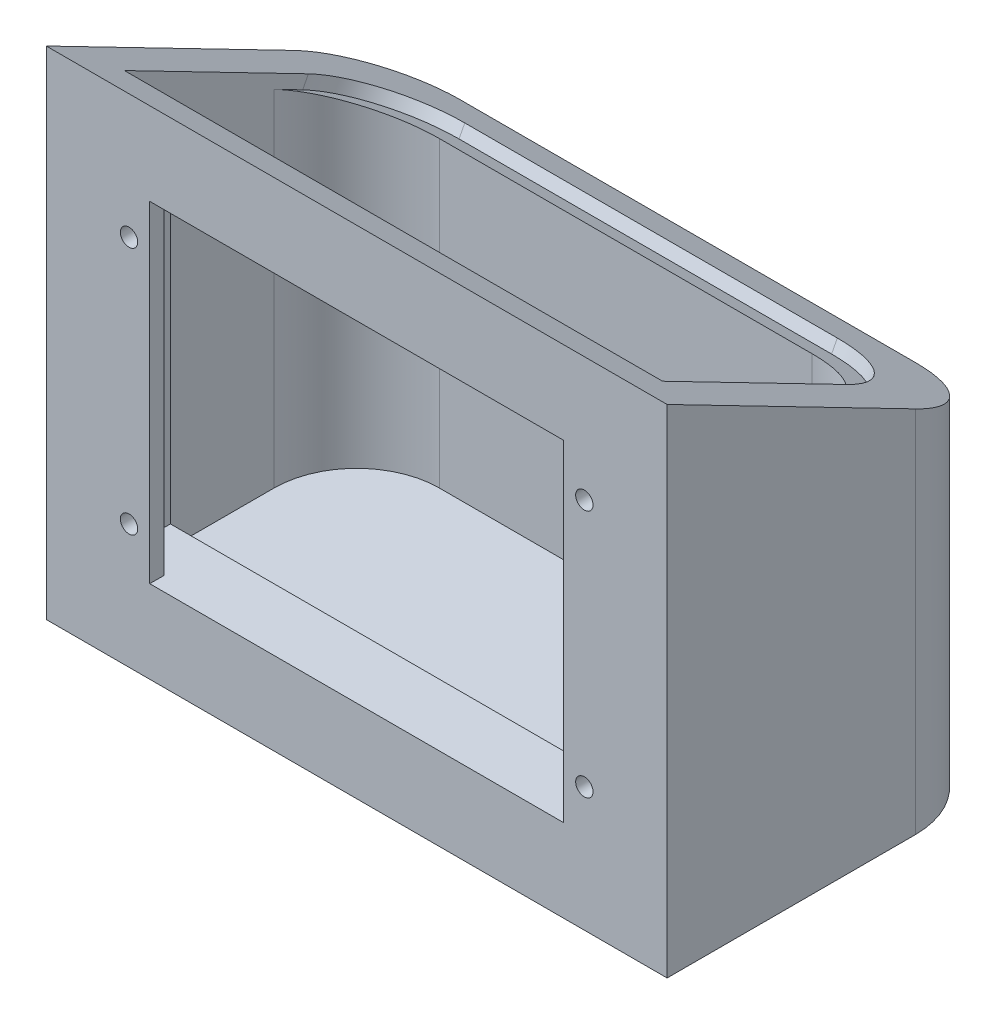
SolidWorks part; units mm, degrees
ref_plane "Alzado" through (0, 0, 0) normal (0, 0, 1) x (1, 0, 0)
ref_plane "Planta" through (0, 0, 0) normal (0, 1, 0) x (1, 0, 0)
ref_plane "Vista lateral" through (0, 0, 0) normal (1, 0, 0) x (0, 0, -1)
sketch "Sketch1" plane through (0, 0, 0) normal (1, 0, 0) x (0, 0, -1)
  line L0 (0, 0) -> (0, 120)
  line L1 (0, 120) -> (80, 78.7689)
  line L2 (80, 78.7689) -> (80, 0)
  line L3 (80, 0) -> (0, 0)
  dimension "D1" = 90
  dimension "D2" = 80
  dimension "D3" = 120
extrude "Boss-Extrude1" add sketch "Sketch1" along normal blind 150
sketch "Sketch2" plane through (0, 94.8148, -48.8664) normal (0, 0.8889, -0.4581) x (1, 0, 0)
  line L0 (150, -54.9747) -> (0, -54.9747) construction
  line L1 (30, 25.0253) -> (120, 25.0253)
  line L2 (10, 5.0253) -> (10, -44.9747)
  line L3 (10, -44.9747) -> (140, -44.9747)
  line L4 (140, 5.0253) -> (140, -44.9747)
  line L5 (0, 35.0253) -> (0, -54.9747) construction
  arc A0 (120, 25.0253) -> (140, 5.0253) centre (120, 5.0253) cw
  arc A1 (30, 25.0253) -> (10, 5.0253) centre (30, 5.0253) ccw
  dimension "D5" = 20
  dimension "D1" = 70
  dimension "D2" = 10
  dimension "D3" = 130
  dimension "D4" = 10
extrude "Cut-Extrude1" cut sketch "Sketch2" against normal blind 3
fillet "Fillet1" radius 20 2 edges at (0, 39.3845, -80) (150, 39.3845, -80)
sketch "Sketch4" plane through (0, 0, 0) normal (0, -1, 0) x (1, 0, 0)
  line L0 (140, -15) -> (140, -45)
  line L5 (30, -65) -> (120, -65)
  line L6 (10, -15) -> (10, -45)
  line L7 (10, -15) -> (140, -15)
  line L8 (150, 0) -> (0, 0) construction
  arc A0 (120, -65) -> (140, -45) centre (120, -45) ccw
  arc A1 (30, -65) -> (10, -45) centre (30, -45) cw
  dimension "D4" = 130
  dimension "D1" = 20
  dimension "D2" = 15
  dimension "D3" = 50
extrude "Cut-Extrude6" cut sketch "Sketch4" against normal up to surface (98.8942 mm away) from offset 10
sketch "Sketch5" plane through (0, 0, 0) normal (0, 0, 1) x (1, 0, 0)
  line L0 (0, 120) -> (0, 0) construction
  line L1 (15, 20) -> (135, 20)
  line L2 (15, 20) -> (15, 100)
  line L3 (15, 100) -> (135, 100)
  line L4 (135, 20) -> (135, 100)
  line L5 (150, 0) -> (0, 0) construction
  line L6 (150, 120) -> (150, 0) construction
  line L7 (150, 120) -> (0, 120) construction
  dimension "D1" = 15
  dimension "D2" = 20
  dimension "D3" = 15
  dimension "D4" = 20
extrude "Cut-Extrude7" cut sketch "Sketch5" against normal up to surface (15 mm away)
sketch "Sketch8" plane through (15, 0, 0) normal (1, 0, 0) x (0, 0, -1)
  line L0 (15, 20) -> (0, 20) construction
  line L1 (0, 100) -> (3.5, 100)
  line L2 (0, 100) -> (0, 20)
  line L3 (0, 20) -> (3.5, 20)
  line L4 (3.5, 100) -> (3.5, 20)
  dimension "D1" = 3.5
extrude "Boss-Extrude2" add sketch "Sketch8" along normal blind 10 contours L4 L3 L2 L1
sketch "Sketch9" plane through (135, 0, 0) normal (-1, 0, 0) x (0, 0, 1)
  line L1 (0, 100) -> (-3.5, 100)
  line L2 (0, 100) -> (0, 20)
  line L3 (0, 20) -> (-3.5, 20)
  line L4 (-3.5, 100) -> (-3.5, 20)
  dimension "D1" = 3.5
extrude "Boss-Extrude3" add sketch "Sketch9" along normal blind 10
sketch "Sketch10" plane through (0, 0, 0) normal (0, 0, 1) x (1, 0, 0)
  line L0 (125, 20) -> (125, 100) construction
  line L1 (125, 100) -> (25, 100) construction
  line L2 (25, 20) -> (125, 20) construction
  line L3 (75, 120) -> (75, -15.5175) construction
  line L4 (150, 120) -> (0, 120) construction
  circle A0 centre (130, 90) radius 2.1
  circle A1 centre (130, 30) radius 2.1
  circle A2 centre (20, 30) radius 2.1
  circle A3 centre (20, 90) radius 2.1
  dimension "D1" = 5
  dimension "D2" = 4.2
  dimension "D6" = 4.2
  dimension "D3" = 10
  dimension "D4" = 10
  dimension "D5" = 5
extrude "Cut-Extrude8" cut sketch "Sketch10" against normal up to surface (3.5 mm away)
